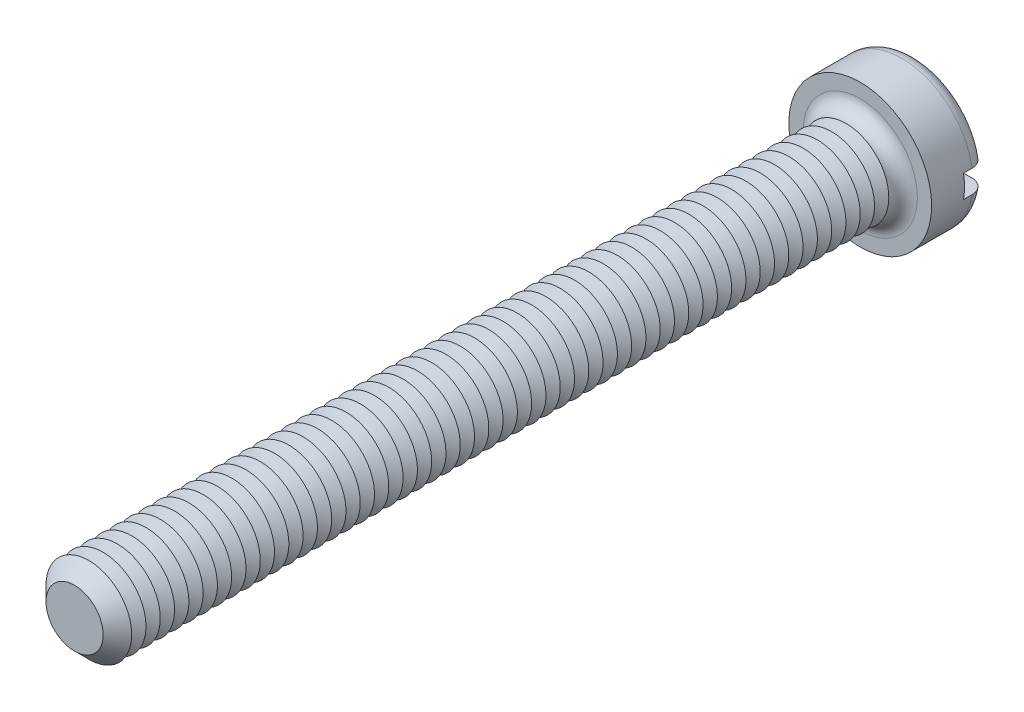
SolidWorks part; units mm, degrees
ref_plane "Front Plane" through (0, 0, 0) normal (0, 0, 1) x (1, 0, 0)
ref_plane "Top Plane" through (0, 0, 0) normal (0, 1, 0) x (1, 0, 0)
ref_plane "Right Plane" through (0, 0, 0) normal (1, 0, 0) x (0, 0, -1)
sketch "Sketch3" plane through (0, 0, 0) normal (0, 0, 1) x (1, 0, 0)
  circle A0 centre (0, 0) radius 5
  dimension "D1" = 10
extrude "Boss-Extrude2" add sketch "Sketch3" against normal blind 3.9
sketch "Sketch4" plane through (0, 0, 0) normal (0, 0, 1) x (1, 0, 0)
  circle A0 centre (0, 0) radius 3
  dimension "D1" = 6
extrude "Boss-Extrude3" add sketch "Sketch4" along normal blind 55
fillet "Fillet1" radius 1 2 edges at (5, 0, -3.9) (3, 0, 0)
chamfer "Chamfer1" distance 1 angle 45 1 edges at (3, 0, 55)
sketch "Sketch5" plane through (0, 0, 0) normal (1, 0, 0) x (0, 0, -1)
  line L0 (1.6944, 0) -> (-7.6738, 0) construction
sketch "Sketch6" plane through (0, 0, 0) normal (1, 0, 0) x (0, 0, -1)
  line L0 (-1, 3) -> (-1.5, 2.134)
  line L1 (-1.5, 2.134) -> (-2, 3)
  line L2 (-1, 3) -> (-54, 3) construction
  line L3 (-2, 3) -> (-1, 3)
  dimension "D1" = 1
revolve "Cut-Revolve1" cut sketch "Sketch6" angle 360 about L0
pattern_linear "LPattern1" count 53 spacing 1 along (0, 0, 1) of "Cut-Revolve1"
sketch "Sketch8" plane through (0, 0, -3.9) normal (0, 0, -1) x (-1, 0, 0)
  line L1 (5, -0.8) -> (-5, -0.8)
  line L2 (5, -0.8) -> (5, 0.8)
  line L3 (5, 0.8) -> (-5, 0.8)
  line L4 (-5, -0.8) -> (-5, 0.8)
  line L5 (5, -0.8) -> (-5, 0.8) construction
  line L6 (5, 0.8) -> (-5, -0.8) construction
  point P0 (0, 0)
  dimension "D1" = 10
  dimension "D2" = 1.6
extrude "Cut-Extrude1" cut sketch "Sketch8" against normal blind 1.6
